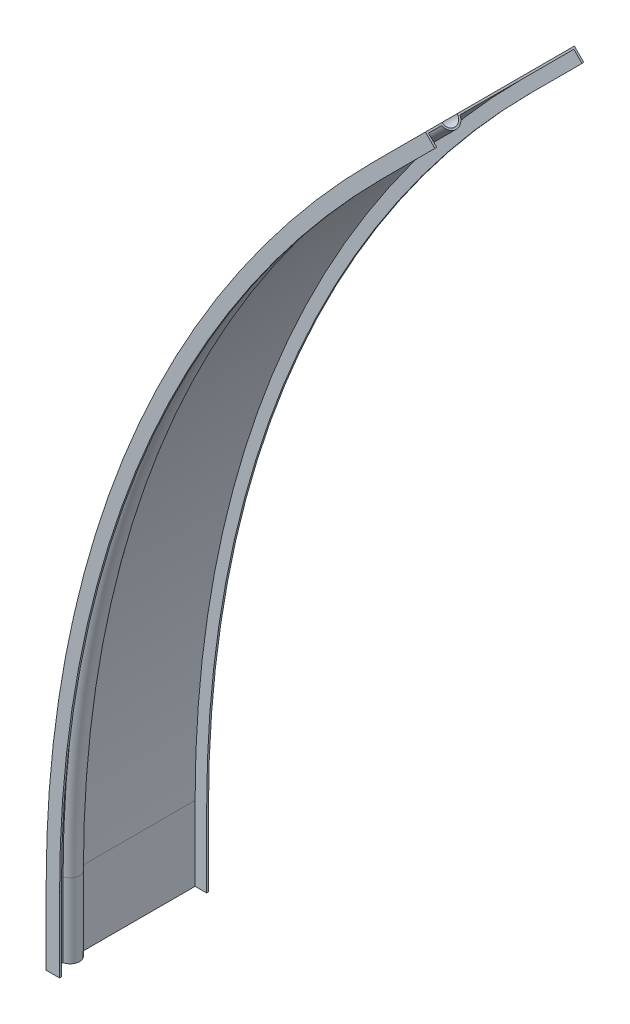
SolidWorks part; units mm, degrees
ref_plane "Front Plane" through (0, 0, 0) normal (0, 0, 1) x (1, 0, 0)
ref_plane "Top Plane" through (0, 0, 0) normal (0, 1, 0) x (1, 0, 0)
ref_plane "Right Plane" through (0, 0, 0) normal (1, 0, 0) x (0, 0, -1)
sketch "Sketch1" plane through (0, 0, 0) normal (0, 0, 1) x (1, 0, 0)
  line L0 (0, 0) -> (597.572, 0) construction
  line L1 (597.572, 0) -> (597.572, 50) construction
  line L2 (641.506, 156.066) -> (676.8613, 191.4214) construction
  line L3 (676.8613, 191.4214) -> (254.3141, 613.9686) construction
  line L4 (254.3141, 613.9686) -> (218.9588, 578.6132)
  line L5 (0, 50) -> (0, 0)
  arc A0 (597.572, 50) -> (641.506, 156.066) centre (747.572, 50) cw construction
  arc A1 (218.9588, 578.6132) -> (0, 50) centre (747.572, 50) ccw
  dimension "D2" = 150
  dimension "D1" = 50
  dimension "D3" = 597.572
  dimension "D4" = 45
sketch "Sketch2" plane through (0, 0, 0) normal (0, 1, 0) x (1, 0, 0)
  line L0 (-1.214, 1.214) -> (7.786, 1.214)
  line L2 (-1.214, 1.214) -> (-1.214, -77.572)
  line L3 (-1.214, -87.572) -> (-1.214, -98.786)
  line L4 (-1.214, -98.786) -> (7.786, -98.786)
  line L5 (7.786, 1.214) -> (7.786, 0)
  line L6 (7.786, 0) -> (0, 0)
  line L7 (0, 0) -> (0, -76.4777)
  line L8 (0, -88.6663) -> (0, -97.572)
  line L9 (0, -97.572) -> (7.786, -97.572)
  line L10 (7.786, -97.572) -> (7.786, -98.786)
  arc A0 (-1.214, -77.572) -> (-1.214, -87.572) centre (-1.214, -82.572) cw
  arc A1 (0, -88.6663) -> (0, -76.4777) centre (-1.214, -82.572) ccw
  dimension "D3" = 5
  dimension "D7" = 1.214
  dimension "D1" = 9
  dimension "D2" = 15
  dimension "D4" = 100
  dimension "D5" = 1.214
  dimension "D6" = 1.214
sweep "Sweep1" add profiles "Sketch2" path "Sketch1"
